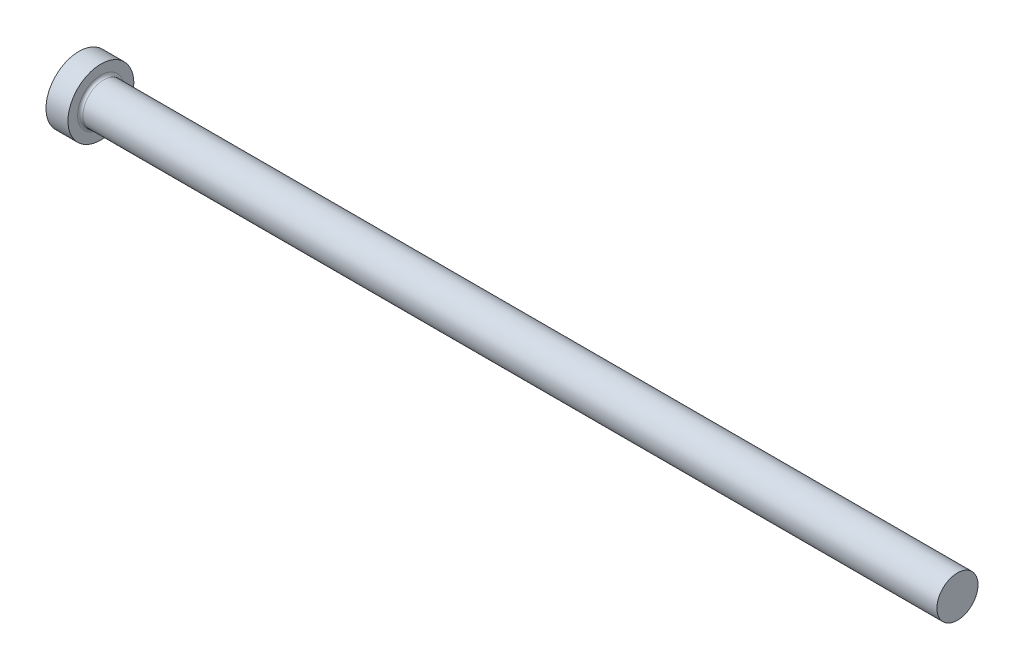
SolidWorks part; units mm, degrees
ref_plane "Front Plane" through (0, 0, 0) normal (0, 0, 1) x (1, 0, 0)
ref_plane "Top Plane" through (0, 0, 0) normal (0, 1, 0) x (1, 0, 0)
ref_plane "Right Plane" through (0, 0, 0) normal (1, 0, 0) x (0, 0, -1)
sketch "Sketch1" plane through (0, 0, 0) normal (0, 0, 1) x (1, 0, 0)
  line L0 (0, 0) -> (0, 9.525)
  line L1 (0, 9.525) -> (6.35, 9.525)
  line L2 (6.35, 9.525) -> (6.35, 6.7348)
  line L3 (7.1374, 5.9474) -> (254, 5.9474)
  line L4 (254, 5.9474) -> (254, 0)
  line L5 (254, 0) -> (0, 0)
  line L6 (254, 0) -> (0, 0) construction
  line L7 (0, 0) -> (-10.4771, 0) construction
  line L8 (254, 0) -> (1002.3976, 0) construction
  arc A0 (7.1374, 5.9474) -> (6.35, 6.7348) centre (7.1374, 6.7348) cw
  dimension "D1" = 0.7874
  dimension "HeadDia" = 19.05
  dimension "HeadThickness" = 6.35
  dimension "PinDia" = 11.8948
  dimension "overall" = 254
revolve "PIN" add sketch "Sketch1" angle 360 about L6
